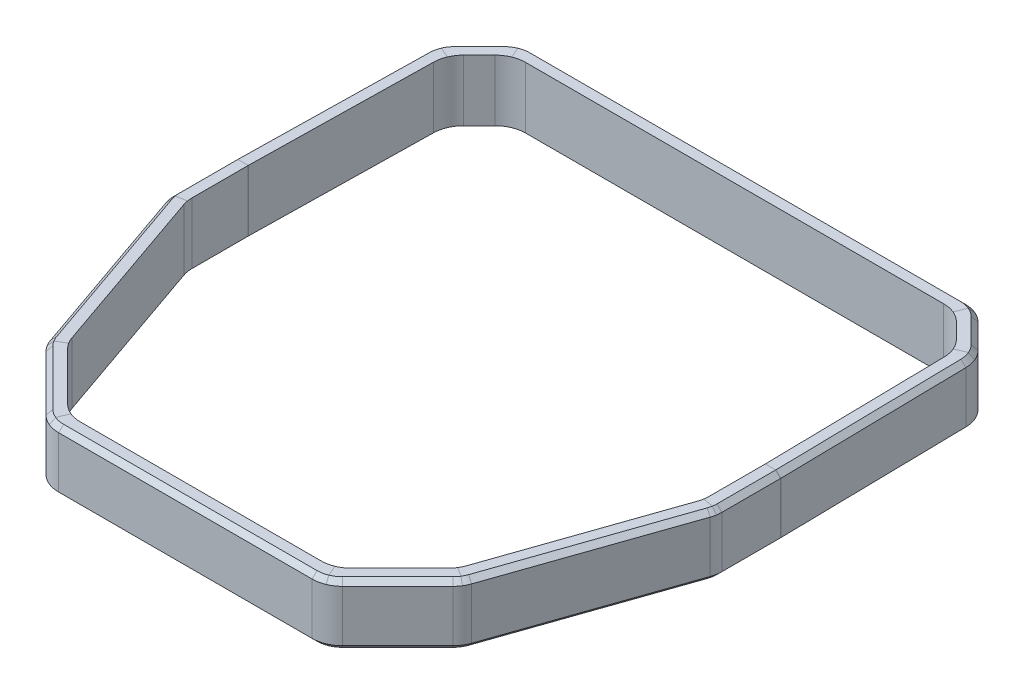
SolidWorks part; units mm, degrees
ref_plane "Front Plane" through (0, 0, 0) normal (0, 0, 1) x (1, 0, 0)
ref_plane "Top Plane" through (0, 0, 0) normal (0, 1, 0) x (1, 0, 0)
ref_plane "Right Plane" through (0, 0, 0) normal (1, 0, 0) x (0, 0, -1)
sketch "Sketch1" plane through (0, 0, 0) normal (1, 0, 0) x (0, 0, -1)
  line L0 (-1.5875, 0) -> (-1.5875, -6.35)
  line L1 (-1.5875, -6.35) -> (0, -6.35)
  line L2 (0, -6.35) -> (0, 0)
  line L3 (0, 0) -> (-1.5875, 0)
  dimension "D1" = 6.35
  dimension "D2" = 1.5875
sketch "Sketch2" plane through (0, 0, 0) normal (0, 1, 0) x (1, 0, 0)
  line L0 (0, 0) -> (-27.6098, 0)
  line L1 (-27.6098, 0) -> (-34.0451, 6.4353)
  line L2 (-40.6273, 25.4) -> (-40.6273, 31.75)
  line L3 (-40.6273, 31.75) -> (-40.271, 51.9336)
  line L5 (12.6612, 51.9336) -> (13.0175, 31.75)
  line L6 (13.0175, 31.75) -> (13.0175, 25.4)
  line L7 (6.4353, 6.4353) -> (0, 0)
  line L8 (-40.271, 51.9336) -> (-36.8046, 55.3999)
  line L9 (-36.8046, 55.3999) -> (9.1948, 55.3999)
  line L10 (9.1948, 55.3999) -> (12.6612, 51.9336)
  line L11 (6.4353, 6.4353) -> (13.0175, 25.4)
  line L12 (-34.0451, 6.4353) -> (-40.6273, 25.4)
  dimension "D1" = 27.6098
  dimension "D2" = 135
  dimension "D3" = 9.1008
  dimension "D4" = 25.4
  dimension "D5" = 6.35
  dimension "D6" = 45.9994
  dimension "D7" = 55.3999
  dimension "D8" = 4.9022
  dimension "D9" = 53.6448
sweep "Sweep1" add profiles "Sketch1" path "Sketch2"
fillet "Fillet1" radius 3.175 24 edges at (-40.6273, -3.175, -31.75) (-40.6273, -3.175, -25.4) (-34.0451, -3.175, -6.4353) (-27.6098, -3.175, 0) (0, -3.175, 0) (6.4353, -3.175, -6.4353) (13.0175, -3.175, -25.4) (13.0175, -3.175, -31.75) (12.6612, -3.175, -51.9336) (9.1948, -3.175, -55.3999) (-36.8046, -3.175, -55.3999) (-40.271, -3.175, -51.9336) (-41.8469, -3.175, -52.6027) (-42.2148, -3.175, -31.764) (-42.2148, -3.175, -25.1323) (-35.4253, -3.175, -5.5704) (-37.4622, -3.175, -56.9874) (9.8524, -3.175, -56.9874) (14.605, -3.175, -31.764) (14.2371, -3.175, -52.6027) (14.605, -3.175, -25.1323) (7.8155, -3.175, -5.5704) (0.6576, -3.175, 1.5875) (-28.2674, -3.175, 1.5875)
chamfer "Chamfer1" distance 0.508 angle 45 72 edges at (11.242, -6.35, -15.4428) (7.9182, -6.35, -5.9279) (14.5059, -6.35, -24.8805) (7.5386, -6.35, -5.3221) (14.5939, -6.35, -25.4028) (4.4438, -6.35, -2.1987) (14.605, -6.35, -28.7018) (1.1064, -6.35, 1.0524) (14.605, -6.35, -31.75) (-0.0382, -6.35, 1.5265) (14.6047, -6.35, -31.778) (-13.8049, -6.35, 1.5875) (14.4321, -6.35, -41.5563) (-27.5716, -6.35, 1.5265) (14.1908, -6.35, -51.925) (-28.7162, -6.35, 1.0524) (13.7174, -6.35, -53.04) (-32.0536, -6.35, -2.1987) (12.0563, -6.35, -54.7835) (-35.1484, -6.35, -5.3221) (10.3012, -6.35, -56.4524) (-35.528, -6.35, -5.9279) (9.1566, -6.35, -56.9264) (-38.8518, -6.35, -15.4428) (-13.8049, -6.35, -56.9874) (-42.1157, -6.35, -24.8805) (-36.7664, -6.35, -56.9264) (-42.2037, -6.35, -25.4028) (-37.911, -6.35, -56.4524) (-42.2148, -6.35, -28.7018) (-39.6661, -6.35, -54.7835) (-42.2148, -6.35, -31.75) (-41.3272, -6.35, -53.04) (-42.2145, -6.35, -31.778) (-41.8006, -6.35, -51.925) (-42.0419, -6.35, -41.5563) (11.242, 0, -15.4428) (7.9182, 0, -5.9279) (14.5059, 0, -24.8805) (7.5386, 0, -5.3221) (14.5939, 0, -25.4028) (4.4438, 0, -2.1987) (14.605, 0, -28.7018) (1.1064, 0, 1.0524) (14.605, 0, -31.75) (-0.0382, 0, 1.5265) (14.6047, 0, -31.778) (-13.8049, 0, 1.5875) (14.4321, 0, -41.5563) (-27.5716, 0, 1.5265) (14.1908, 0, -51.925) (-28.7162, 0, 1.0524) (13.7174, 0, -53.04) (-32.0536, 0, -2.1987) (12.0563, 0, -54.7835) (-35.1484, 0, -5.3221) (10.3012, 0, -56.4524) (-35.528, 0, -5.9279) (9.1566, 0, -56.9264) (-38.8518, 0, -15.4428) (-13.8049, 0, -56.9874) (-42.1157, 0, -24.8805) (-36.7664, 0, -56.9264) (-42.2037, 0, -25.4028) (-37.911, 0, -56.4524) (-42.2148, 0, -28.7018) (-39.6661, 0, -54.7835) (-42.2148, 0, -31.75) (-41.3272, 0, -53.04) (-42.2145, 0, -31.778) (-41.8006, 0, -51.925) (-42.0419, 0, -41.5563)
